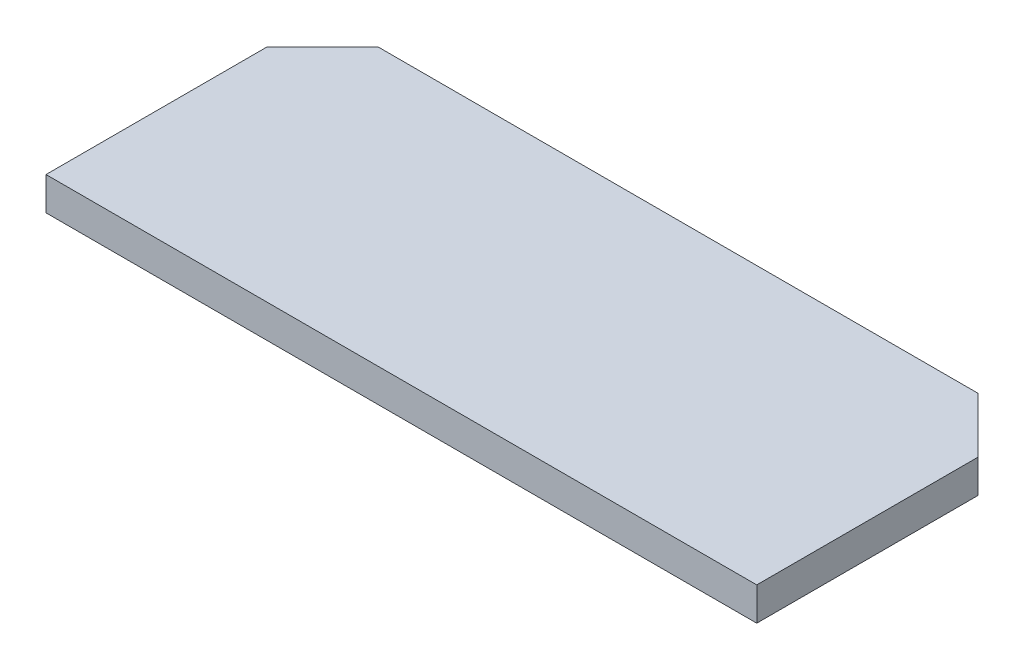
SolidWorks part; units mm, degrees
ref_plane "Płaszczyzna przednia" through (0, 0, 0) normal (0, 0, 1) x (1, 0, 0)
ref_plane "Płaszczyzna górna" through (0, 0, 0) normal (0, 1, 0) x (1, 0, 0)
ref_plane "Płaszczyzna prawa" through (0, 0, 0) normal (1, 0, 0) x (0, 0, -1)
sketch "Szkic1" plane through (0, 0, 0) normal (0, 1, 0) x (1, 0, 0)
  line L1 (0, 0) -> (257, 0)
  line L2 (0, 0) -> (0, -100)
  line L3 (0, -100) -> (257, -100)
  line L4 (257, 0) -> (257, -100)
  line L5 (0, 0) -> (257, -100) construction
  line L6 (0, -100) -> (257, 0) construction
  point P4 (128.5, -50)
  dimension "D1" = 257
  dimension "D2" = 100
extrude "Dodanie-wyciągnięcie1" add sketch "Szkic1" along normal blind 12
chamfer "Sfazowanie1" distance 20 angle 45 2 edges at (0, 6, 0) (257, 6, 0)
ref_plane "Płaszczyzna2" through (0, 12, 100) normal (0, 0, 1) x (1, 0, 0)
sketch "Szkic3" plane through (0, 12, 0) normal (0, 1, 0) x (1, 0, 0)
  line L0 (0, -100) -> (0, -20) construction
  line L1 (0, -20) -> (20, 0) construction
  line L2 (20, 0) -> (237, 0) construction
  line L3 (237, 0) -> (257, -20) construction
  line L4 (257, -20) -> (257, -100) construction
  line L5 (257, -100) -> (0, -100) construction
  dimension "D1" = 80
  dimension "D2" = 257
  dimension "D3" = 80
  dimension "D4" = 28.2843
  dimension "D5" = 20
  dimension "D6" = 20
  dimension "D7" = 217
